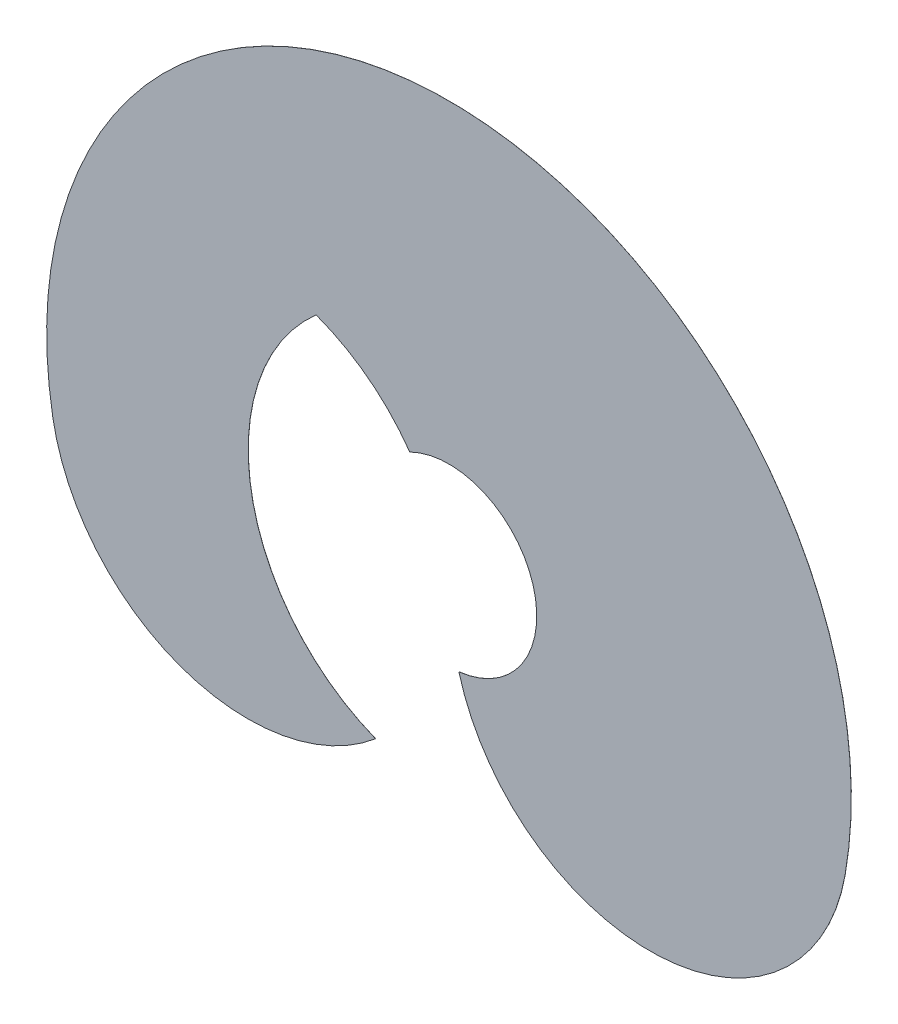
SolidWorks part; units mm, degrees
ref_plane "前视基准面" through (0, 0, 0) normal (0, 0, 1) x (1, 0, 0)
ref_plane "上视基准面" through (0, 0, 0) normal (0, 1, 0) x (1, 0, 0)
ref_plane "右视基准面" through (0, 0, 0) normal (1, 0, 0) x (0, 0, -1)
sketch "草图1" plane through (0, 0, 0) normal (0, 0, 1) x (1, 0, 0)
  line L0 (0, 0) -> (0, 1951.8831) construction
  line L1 (250, 610.5) -> (250, 1780.5) construction
  line L2 (250, 1780.5) -> (250, 2915.2639) construction
  line L3 (250, 2915.2639) -> (446.8692, 1815.7496) construction
  line L4 (446.8692, 1815.7496) -> (250, 1780.5) construction
  line L5 (250, 610.5) -> (1402.2251, 407.3316) construction
  line L6 (250, 610.5) -> (-902.2251, 407.3316) construction
  line L7 (250, 1780.5) -> (732.286, 753.3247) construction
  line L8 (250, 1780.5) -> (443.1852, 1832.2638) construction
  line L9 (443.1852, 1832.2638) -> (732.286, 753.3247) construction
  line L10 (250, 1780.5) -> (-731.2326, 1210.525) construction
  line L11 (250, 1780.5) -> (318.404, 1592.5615) construction
  line L12 (318.404, 1592.5615) -> (-731.2326, 1210.525) construction
  line L13 (250, 1780.5) -> (-59.9278, 1780.5) construction
  arc A0 (2519.7493, 210.282) -> (-2019.7493, 210.282) centre (250, 610.5) ccw
  arc A1 (306.9067, 110.7397) -> (25.5971, 1060.6578) centre (250, 610.5) ccw
  arc A2 (306.9067, 110.7397) -> (2519.7493, 210.282) centre (1402.2251, 407.3316) ccw
  arc A3 (-2019.7493, 210.282) -> (-170.52, -460.0187) centre (-902.2251, 407.3316) ccw
  arc A4 (25.5971, 1060.6578) -> (-511.2985, 1472.6323) centre (-902.2251, 407.3316) ccw
  arc A7 (-511.2985, 1472.6323) -> (-170.52, -460.0187) centre (250, 610.5) ccw
  dimension "D2" = 250
  dimension "D3" = 1170
  dimension "D4" = 200
  dimension "D5" = 1117
  dimension "D6" = 100
  dimension "D7" = 1170
  dimension "D8" = 100
  dimension "D9" = 1170
  dimension "D10" = 165
  dimension "D11" = 200
  dimension "D12" = 1117
  dimension "D13" = 1117
  dimension "D14" = 200
  dimension "D16" = 610.5
  dimension "D17" = 110
extrude "凸台-拉伸1" add sketch "草图1" along normal blind 0.5
